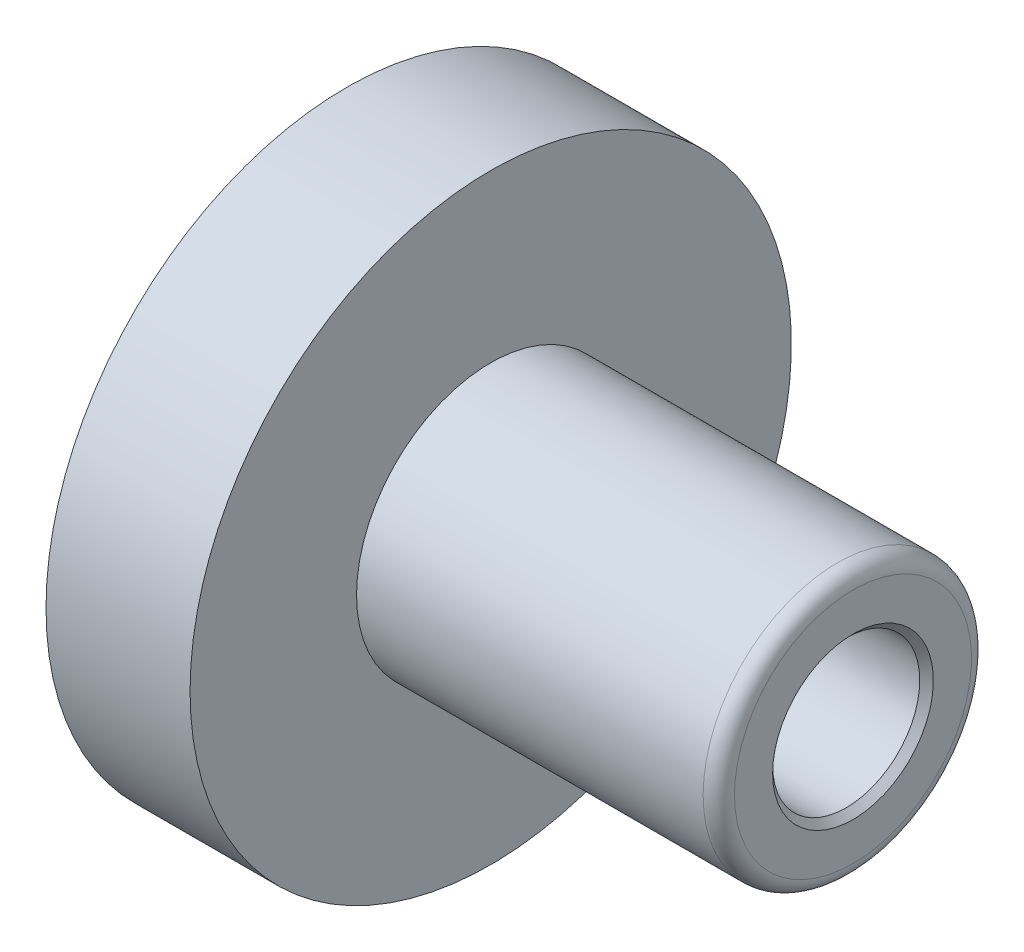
SolidWorks part; units mm, degrees
ref_plane "Front Plane" through (0, 0, 0) normal (0, 0, 1) x (1, 0, 0)
ref_plane "Top Plane" through (0, 0, 0) normal (0, 1, 0) x (1, 0, 0)
ref_plane "Right Plane" through (0, 0, 0) normal (1, 0, 0) x (0, 0, -1)
sketch "Sketch1" plane through (0, 0, 0) normal (0, 0, 1) x (1, 0, 0)
  line L0 (0, 0) -> (102.3864, 0) construction
  line L1 (0, 9.906) -> (0, 30.1625)
  line L2 (0, 30.1625) -> (14.4526, 30.1625)
  line L3 (14.4526, 30.1625) -> (14.4526, 13.462)
  line L4 (14.4526, 13.462) -> (49.2252, 13.462)
  line L5 (50.8, 11.8872) -> (50.8, 0)
  line L6 (50.8, 0) -> (30.9372, 0)
  line L7 (0, 9.906) -> (30.9372, 9.906)
  line L8 (30.9372, 9.906) -> (30.9372, 0)
  arc A0 (50.8, 11.8872) -> (49.2252, 13.462) centre (49.2252, 11.8872) ccw
  dimension "D5" = 1.5748
  dimension "D1" = 14.4526
  dimension "D2" = 60.325
  dimension "D3" = 30.9372
  dimension "D4" = 19.812
  dimension "D6" = 50.8
  dimension "D7" = 26.924
revolve "Revolve1" add sketch "Sketch1" angle 360 about L0
sketch "Sketch2" plane through (0, 0, 0) normal (-1, 0, 0) x (0, 0, 1)
  line L0 (0, 0) -> (0, 9.7644) construction
  circle A0 centre (-19.939, 0) radius 3.2004
  circle A1 centre (19.939, 0) radius 3.2004
  dimension "D2" = 6.4008
  dimension "D1" = 39.878
extrude "Cut-Extrude1" cut sketch "Sketch2" against normal blind 7.9502
sketch "Sketch3" plane through (50.8, 0, 0) normal (1, 0, 0) x (0, 0, -1)
  circle A0 centre (0, 0) radius 7.3787
  dimension "D1" = 14.7574
extrude "Cut-Extrude2" cut sketch "Sketch3" against normal through all
chamfer "Chamfer1" distance 0.6858 angle 45 1 edges at (50.8, 0, -7.3787)
